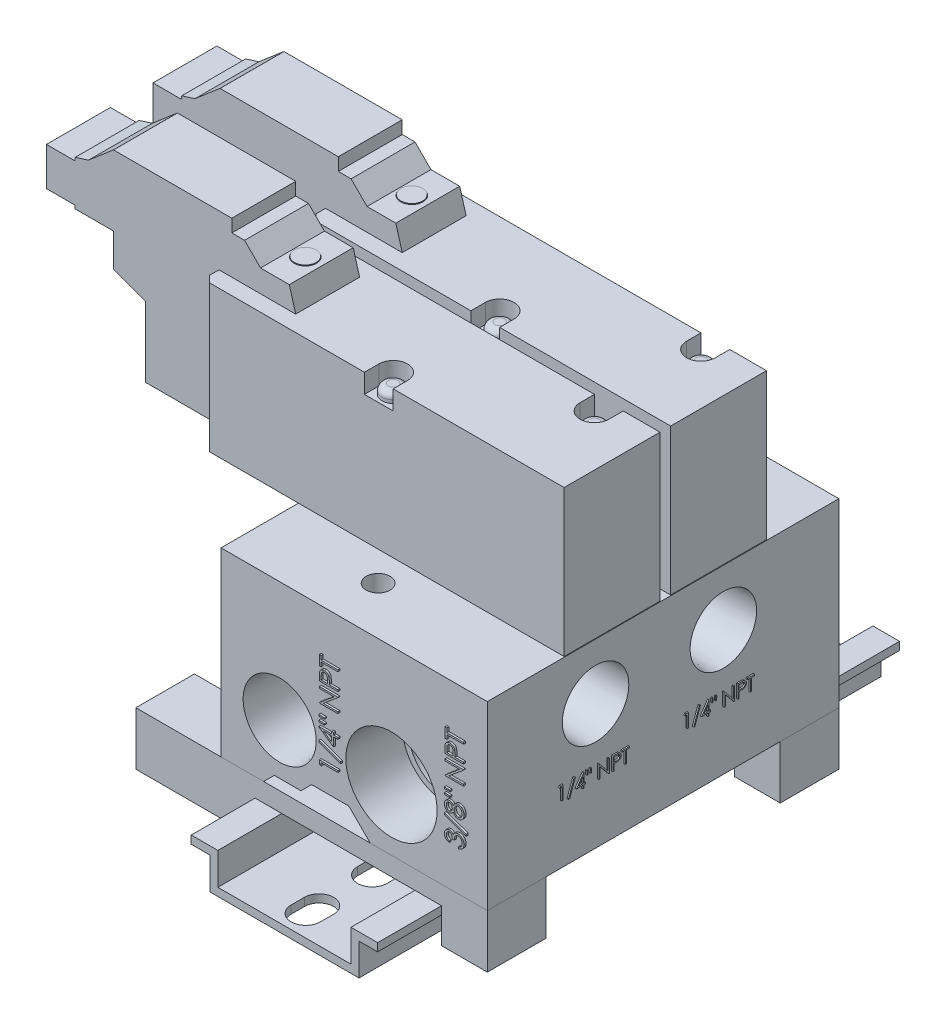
SolidWorks part; units mm, degrees
ref_plane "Front Plane" through (0, 0, 0) normal (0, 0, 1) x (1, 0, 0)
ref_plane "Top Plane" through (0, 0, 0) normal (0, 1, 0) x (1, 0, 0)
ref_plane "Right Plane" through (0, 0, 0) normal (1, 0, 0) x (0, 0, -1)
imported_body "VV3QZ35-0202TC-D_VV3QZ1929manifold-1-solid1"
imported_body "VV3QZ35-0202TC-D_VV5Q Fittings-1-solid1"
imported_body "VV3QZ35-0202TC-D_VQ1000-10A-1-60-1-solid1"
imported_body "VV3QZ35-0202TC-D_VQ1000-10A-1-60-2-solid1"
imported_body "VV3QZ35-0202TC-D_AXT100-DR-1-solid1"
imported_body "VV3QZ35-0202TC-D_VV5Q Fittings-2-solid1"
imported_body "VQZ235-5LO-1/VQZ235-5LO_VQZ1929VALVEBODY-1-solid1"
imported_body "VQZ235-5LO-1/VQZ235-5LO_man_op-PL-1-solid1"
imported_body "VQZ235-5LO-1/VQZ235-5LO_VQZCOIL-1-solid1"
imported_body "VQZ235-5LO-2/VQZ235-5LO_VQZ1929VALVEBODY-1-solid1"
imported_body "VQZ235-5LO-2/VQZ235-5LO_man_op-PL-1-solid1"
imported_body "VQZ235-5LO-2/VQZ235-5LO_VQZCOIL-1-solid1"
sketch "Sketch1" plane through (0, 0, -66) normal (0, 0, -1) x (-1, 0, 0)
  circle A0 centre (-32, 11.5) radius 7.25 construction
  circle A1 centre (-32, 11.5) radius 7.25
extrude "Extrude1" add sketch "Sketch1" against normal up to vertex
sketch "Sketch2" plane through (0, 0, 0) normal (0, 0, 1) x (1, 0, 0)
  circle A0 centre (32, 11.5) radius 7.25 construction
  circle A1 centre (32, 11.5) radius 7.25
hole_wizard "3/8 NPT Tapped Hole1" positions "3DSketch1" profile "Sketch3" size "3/8" standard "Ansi Inch"
sketch3d "3DSketch1"
  point P0 (32, 11.5, -66)
sketch "Sketch3" plane through (32, 11.5, -66) normal (1, 0, 0) x (0, 1, 0)
  line L0 (0, 0) -> (0, 21.6673)
  line L1 (7.1374, 17.3787) -> (0, 21.6673)
  line L2 (-7.1374, 17.3787) -> (0, 21.6673) construction
  line L3 (7.1374, 17.3787) -> (7.1374, 10.3302)
  line L4 (7.1374, 10.3302) -> (8.2632, 10.3302)
  line L5 (8.2632, 10.3302) -> (8.5725, 0)
  line L6 (-8.2632, 10.3302) -> (-8.5725, 0) construction
  line L7 (8.5725, 0) -> (0, 0)
  line L8 (0, -6.35) -> (0, 107.95) construction
  line L11 (-7.1374, 10.3302) -> (-8.2632, 10.3302) construction
  dimension "Tap Drill Dia." = 14.2748
  dimension "Tap Drill Depth" = 17.3787
  dimension "Thread Dia." = 17.145
  dimension "Thread Angle" = 3.43
  dimension "Thread Depth" = 10.3302
  dimension "Drill Angle" = 118
hole_wizard "3/8 NPT Tapped Hole2" positions "3DSketch2" profile "Sketch4" size "3/8" standard "Ansi Inch"
sketch3d "3DSketch2"
  point P0 (32, 11.5, 0)
sketch "Sketch4" plane through (32, 11.5, 0) normal (1, 0, 0) x (0, -1, 0)
  line L0 (0, 0) -> (0, 21.6673)
  line L1 (7.1374, 17.3787) -> (0, 21.6673)
  line L2 (-7.1374, 17.3787) -> (0, 21.6673) construction
  line L3 (7.1374, 17.3787) -> (7.1374, 10.3302)
  line L4 (7.1374, 10.3302) -> (8.2632, 10.3302)
  line L5 (8.2632, 10.3302) -> (8.5725, 0)
  line L6 (-8.2632, 10.3302) -> (-8.5725, 0) construction
  line L7 (8.5725, 0) -> (0, 0)
  line L8 (0, -6.35) -> (0, 107.95) construction
  line L11 (-7.1374, 10.3302) -> (-8.2632, 10.3302) construction
  dimension "Tap Drill Dia." = 14.2748
  dimension "Tap Drill Depth" = 17.3787
  dimension "Thread Dia." = 17.145
  dimension "Thread Angle" = 3.43
  dimension "Thread Depth" = 10.3302
  dimension "Drill Angle" = 118
sketch "Sketch5" plane through (0, 0, -66) normal (0, 0, -1) x (-1, 0, 0)
  circle A0 centre (-11, 11.5) radius 5.5 construction
  circle A1 centre (-11, 11.5) radius 5.5
extrude "Extrude2" add sketch "Sketch5" against normal up to vertex
sketch "Sketch6" plane through (0, 0, 0) normal (0, 0, 1) x (1, 0, 0)
  circle A0 centre (11, 11.5) radius 5.5 construction
  circle A1 centre (11, 11.5) radius 5.5
hole_wizard "1/4 NPT Tapped Hole1" positions "3DSketch3" profile "Sketch7" size "1/4" standard "Ansi Inch"
sketch3d "3DSketch3"
  point P0 (11, 11.5, -66)
  point P3 (11, 11.5, 0)
sketch "Sketch7" plane through (11, 11.5, -66) normal (1, 0, 0) x (0, 1, 0)
  line L0 (0, 0) -> (0, 20.4111)
  line L1 (5.5626, 17.0688) -> (0, 20.4111)
  line L2 (-5.5626, 17.0688) -> (0, 20.4111) construction
  line L3 (5.5626, 17.0688) -> (5.5626, 10.0203)
  line L4 (5.5626, 10.0203) -> (6.546, 10.0203)
  line L5 (6.546, 10.0203) -> (6.858, 0)
  line L6 (-6.546, 10.0203) -> (-6.858, 0) construction
  line L7 (6.858, 0) -> (0, 0)
  line L8 (0, -6.35) -> (0, 107.95) construction
  line L11 (-5.5626, 10.0203) -> (-6.546, 10.0203) construction
  dimension "Tap Drill Dia." = 11.1252
  dimension "Tap Drill Depth" = 17.0688
  dimension "Thread Dia." = 13.716
  dimension "Thread Angle" = 3.567
  dimension "Thread Depth" = 10.0203
  dimension "Drill Angle" = 118
sketch "Sketch8" plane through (0, 0, -66) normal (0, 0, -1) x (-1, 0, 0)
  line L0 (-46.1702, 24.2822) -> (-46.1702, 4.2333) construction
  line L1 (-22.2968, 24.2822) -> (-22.2968, 6.9814) construction
  text T0 "3/8\" NPT"
  text T1 "1/4\" NPT"
extrude "Extrude3" add sketch "Sketch8" along normal blind 0.381
sketch "Sketch9" plane through (0, 0, 0) normal (0, 0, 1) x (1, 0, 0)
  line L0 (45.9073, 7.6094) -> (45.9073, 28.5436) construction
  line L1 (22.3243, 7.6094) -> (22.3243, 26.6165) construction
  text T0 "3/8\" NPT"
  text T1 "1/4\" NPT"
extrude "Extrude4" add sketch "Sketch9" along normal blind 0.381
other "DeleteFace2"
hole_wizard "1/4 NPT Tapped Hole2" positions "Sketch12" profile "Sketch11" size "1/4" standard "Ansi Inch"
sketch "Sketch12" plane through (50, 0, 0) normal (1, 0, 0) x (0, 0, -1)
  line L0 (20.32, 23.5) -> (44.32, 23.5) construction
  line L2 (66, 34) -> (0, 34) construction
  line L3 (0, 0) -> (0, 34) construction
  point P0 (44.32, 23.5)
  point P1 (20.32, 23.5)
  dimension "D1" = 10.5
  dimension "D2" = 20.32
  dimension "D3" = 24
sketch "Sketch11" plane through (50, 23.5, -44.32) normal (0, 1, 0) x (0, 0, -1)
  line L0 (0, 0) -> (0, 20.4111)
  line L1 (5.5626, 17.0688) -> (0, 20.4111)
  line L2 (-5.5626, 17.0688) -> (0, 20.4111) construction
  line L3 (5.5626, 17.0688) -> (5.5626, 10.0203)
  line L4 (5.5626, 10.0203) -> (5.9437, 10.0203)
  line L5 (5.9437, 10.0203) -> (6.2437, 0)
  line L6 (-5.9437, 10.0203) -> (-6.2437, 0) construction
  line L7 (6.2437, 0) -> (0, 0)
  line L8 (0, -6.35) -> (0, 107.95) construction
  line L11 (-5.5626, 10.0203) -> (-5.9437, 10.0203) construction
  dimension "Tap Drill Dia." = 11.1252
  dimension "Tap Drill Depth" = 17.0688
  dimension "Thread Dia." = 12.4874
  dimension "Thread Angle" = 3.43
  dimension "Thread Depth" = 10.0203
  dimension "Drill Angle" = 118
sketch "Sketch13" plane through (50, 0, 0) normal (1, 0, 0) x (0, 0, -1)
  line L1 (12.8821, 11.0812) -> (27.5092, 11.0812) construction
  text T1 "1/4\" NPT" font "Century Gothic" height 2.54
extrude "Extrude5" add sketch "Sketch13" along normal blind 0.254
pattern_linear "LPattern1" count 2 spacing 23.5069 along (0, 0, -1) of "Extrude5"
combine bodies "Combine2" operation type add bodies to combine 109 108 107
scale "Scale1" bodies to scale 125 scale about centroid uniform scaling yes scale factor 1.2
move or copy body "Body-Move/Copy1" bodies to move or copy 126 placed by mates yes
other "Distance1" parameters "D1"=13.5831
sketch "LOGO"
delete or keep bodies "Body-Delete2" type delete bodies bodies 110 111 112
pattern_linear "LPattern3" count 2 spacing 20 along (0, 0, 1)
